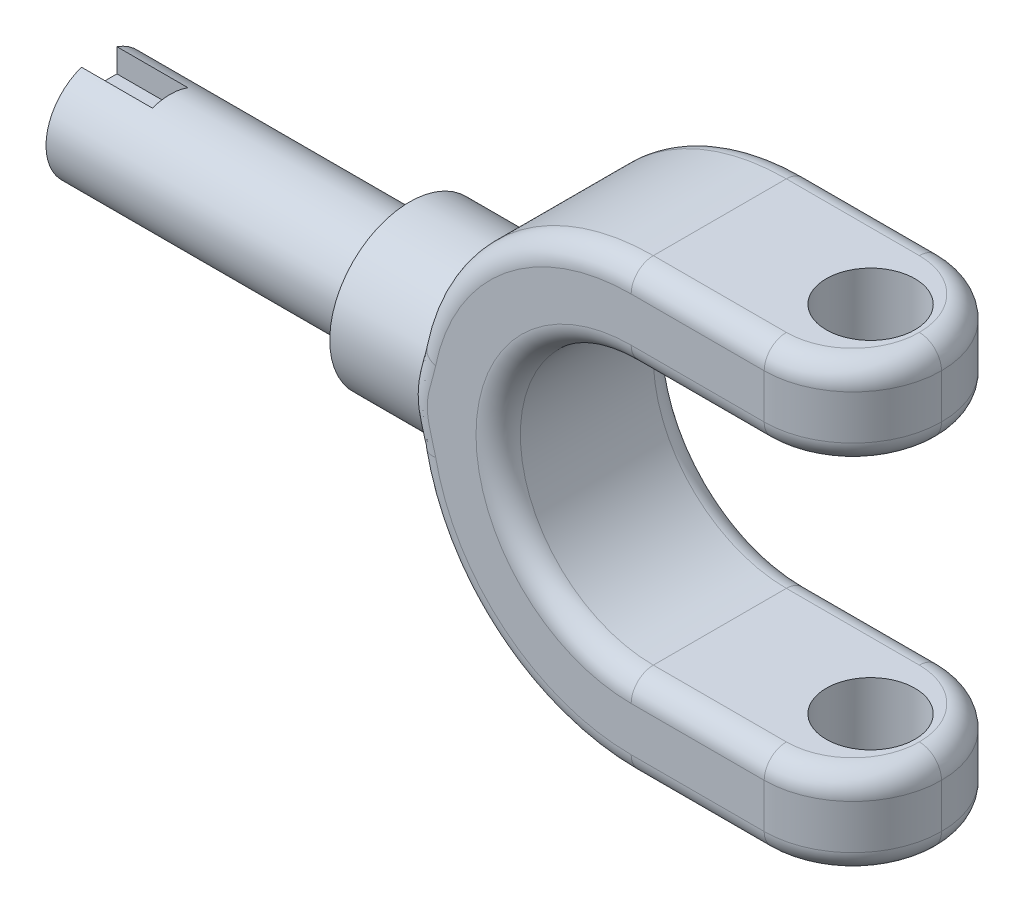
SolidWorks part; units mm, degrees
ref_plane "Plan 1" through (0, 0, 0) normal (0, 0, 1) x (1, 0, 0)
ref_plane "Plan 2" through (0, 0, 0) normal (0, 1, 0) x (1, 0, 0)
ref_plane "Plan 3" through (0, 0, 0) normal (1, 0, 0) x (0, 0, -1)
sketch "Esquisse1" plane through (0, 0, 0) normal (0, 0, 1) x (1, 0, 0)
  line L0 (25, 25) -> (0, 25)
  line L1 (25, 15) -> (0, 15)
  line L2 (0, 0) -> (99, 0) construction
  line L3 (25, -15) -> (0, -15)
  line L4 (25, -25) -> (0, -25)
  line L5 (25, 25) -> (25, 15)
  line L6 (25, -15) -> (25, -25)
  arc A0 (0, 15) -> (0, -15) centre (0, 0) ccw
  arc A1 (0, 25) -> (0, -25) centre (0, 0) ccw
  dimension "D1" = 30
  dimension "D2" = 50
  dimension "D3" = 25
extrude "Base-Extrusion" add sketch "Esquisse1" along normal blind 20
sketch "Esquisse2" plane through (0, 25, 0) normal (0, 1, 0) x (-1, 0, 0)
  line L0 (-25, 10) -> (-9, 10) construction
  line L1 (-25, 20) -> (-25, 0) construction
  circle A0 centre (-17, 10) radius 5
  dimension "D1" = 10
  dimension "D2" = 8
extrude "Enlèv. mat.-Extru.1" cut sketch "Esquisse2" against normal through all
ref_plane "Plan1" through (-70, 0, 0) normal (1, 0, 0) x (0, 0, -1)
sketch "Esquisse3" plane through (-70, 0, 0) normal (1, 0, 0) x (0, 0, -1)
  line L0 (-20, 0) -> (0, 0) construction
  line L1 (-10, 0) -> (-20, 0) construction
  line L2 (-10, 0) -> (0, 0) construction
  line L3 (-20, 25) -> (-20, -25) construction
  circle A0 centre (-10, 0) radius 6
  dimension "D1" = 12
extrude "Boss.-Extru.1" add sketch "Esquisse3" along normal up to next
ref_plane "Plan2" through (-35, 0, 0) normal (1, 0, 0) x (0, 0, -1)
sketch "Esquisse4" plane through (-35, 0, 0) normal (1, 0, 0) x (0, 0, -1)
  line L0 (-20, 0) -> (0, 0) construction
  circle A0 centre (-10, 0) radius 9
  dimension "D1" = 18
extrude "Boss.-Extru.2" add sketch "Esquisse4" along normal up to next
fillet "Congé1" radius 10 8 edges at (25, 20, 20) (25, -15, 10) (25, -25, 10) (25, 25, 10) (25, 15, 10) (25, -20, 20) (25, -20, 0) (25, 20, 0)
fillet "Congé2" radius 2.5 20 edges at (-25, 0, 20) (7.5, -25, 20) (-15, 0, 20) (7.5, 25, 20) (7.5, -15, 20) (7.5, 25, 0) (22.0711, 25, 2.9289) (22.0711, 25, 17.0711) (22.0711, 15, 2.9289) (22.0711, 15, 17.0711) (7.5, -15, 0) (22.0711, -15, 2.9289) (22.0711, -15, 17.0711) (22.0711, -25, 2.9289) (22.0711, -25, 17.0711) (7.5, 15, 20) (7.5, -25, 0) (-25, 0, 0) (7.5, 15, 0) (-15, 0, 0)
sketch "Esquisse5" plane through (-70, 0, 0) normal (-1, 0, 0) x (0, 0, 1)
  line L0 (10, 11.4356) -> (10, -14.1772) construction
  line L1 (10, -25) -> (10, -15) construction
  line L4 (8, 5.6569) -> (8, 3)
  line L5 (8, 3) -> (12, 3)
  line L6 (12, 5.6569) -> (12, 3)
  circle A0 centre (10, 0) radius 6 construction
  arc A1 (12, 5.6569) -> (8, 5.6569) centre (10, 0) ccw
  dimension "D1" = 4
  dimension "D2" = 3
extrude "Enlèv. mat.-Extru.2" cut sketch "Esquisse5" against normal blind 8
sketch "Esq_WRNL_Compact001" plane through (0, 0, 0) normal (0, 0, 1) x (1, 0, 0)
  line L0 (-71, -26) -> (-71, 26)
  line L1 (26, -26) -> (26, 26)
  line L2 (-71, -26) -> (26, -26)
  line L3 (-71, 26) -> (26, 26)
